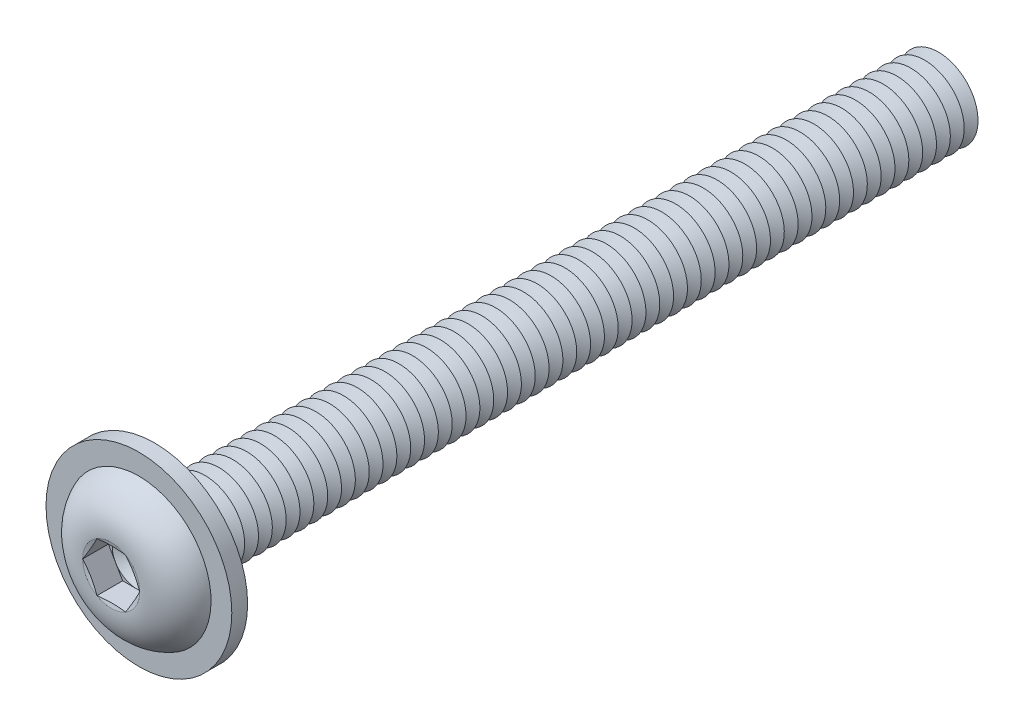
SolidWorks part; units mm, degrees
ref_plane "Front Plane" through (0, 0, 0) normal (0, 0, 1) x (1, 0, 0)
ref_plane "Top Plane" through (0, 0, 0) normal (0, 1, 0) x (1, 0, 0)
ref_plane "Right Plane" through (0, 0, 0) normal (1, 0, 0) x (0, 0, -1)
sketch "Sketch1" plane through (0, 0, 0) normal (1, 0, 0) x (0, 0, -1)
  line L0 (0, 2) -> (0, 3.8)
  line L3 (0, 2) -> (40, 2)
  line L4 (40, 2) -> (40, 0)
  line L5 (40, 0) -> (-2.2, 0) construction
  line L6 (-2.2, 0) -> (40, 0)
  line L7 (-2.2, 1.4434) -> (-2.2, 0.7217) construction
  line L8 (-2.2, 0.7217) -> (-2.2, 0)
  line L9 (-2.2, 1.4434) -> (-2.0066, 0.7217)
  line L10 (-2.0066, 0.7217) -> (-2.2, 0.7217)
  line L11 (40, 0) -> (22.7481, 0) construction
  line L12 (0, 3.8) -> (-2.2, 3.8) construction
  arc A1 (0, 3.8) -> (-2.2, 1.4434) centre (0, 1.5948) ccw
  point P8 (40, 1)
  dimension "D1" = 7.6
  dimension "D2" = 4
  dimension "D3" = 2.2
  dimension "D4" = 2.8868
  dimension "D5" = 40
  dimension "D6" = 15
revolve "Revolve1" add sketch "Sketch1" angle 360 about L5
fillet "Fillet1" radius 0.35 1 edges at (0, 2, 0)
sketch "Sketch2" plane through (0, 0, 0) normal (1, 0, 0) x (0, 0, -1)
  line L0 (39.65, 2) -> (40.35, 2)
  line L1 (40, 2) -> (0.35, 2) construction
  line L2 (40.35, 2) -> (40, 1.3938)
  line L3 (40, -2) -> (40, 2) construction
  line L4 (40, 1.3938) -> (39.65, 2)
  dimension "D1" = 0.7
revolve "Cut-Revolve1" cut sketch "Sketch2" angle 360 about axis through (0, 0, -40) along (0, 0, -1)
pattern_linear "LPattern1" count 57 spacing 0.7 along (0, 0, 1) of "Cut-Revolve1"
sketch "Sketch3" plane through (0, 0, 2.2) normal (0, 0, 1) x (1, 0, 0)
  line L7 (0.7217, 1.25) -> (-0.7217, 1.25)
  line L8 (-0.7217, 1.25) -> (-1.4434, 0)
  line L9 (-1.4434, 0) -> (-0.7217, -1.25)
  line L10 (-0.7217, -1.25) -> (0.7217, -1.25)
  line L11 (0.7217, -1.25) -> (1.4434, 0)
  line L12 (1.4434, 0) -> (0.7217, 1.25)
  circle A0 centre (0, 0) radius 1.25 construction
  circle A3 centre (0, 0) radius 1.4434 construction
extrude "Cut-Extrude1" cut sketch "Sketch3" against normal blind 1.3
sketch "Sketch4" plane through (0, 0, 0.9) normal (0, 0, 1) x (1, 0, 0)
  line L1 (0.7217, 1.25) -> (-0.7217, 1.25) construction
  circle A0 centre (0, 0) radius 1.25
extrude "Cut-Extrude2" cut sketch "Sketch4" against normal through all draft 60
sketch "Sketch5" plane through (0, 0, 0) normal (0, 0, -1) x (-1, 0, 0)
  circle A0 centre (0, 0) radius 4.7
  circle A1 centre (0, 0) radius 2.35
  circle A2 centre (0, 0) radius 2.35 construction
  dimension "D1" = 9.4
extrude "Boss-Extrude1" add sketch "Sketch5" against normal blind 0.8
